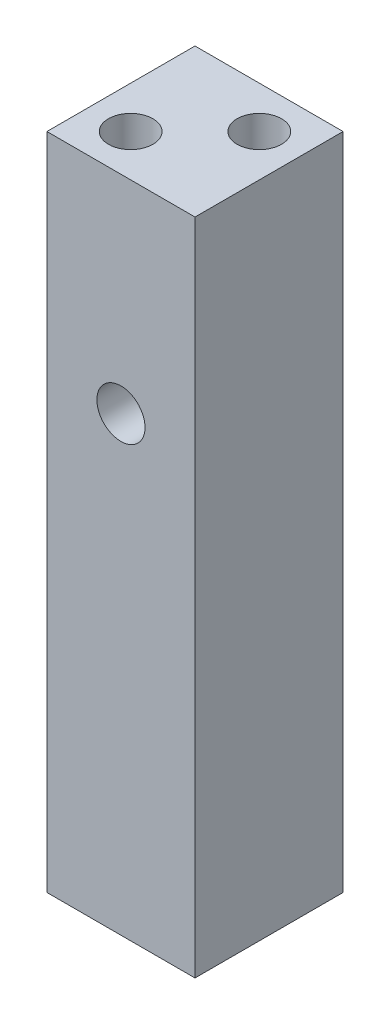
SolidWorks part; units mm, degrees
ref_plane "Front Plane" through (0, 0, 0) normal (0, 0, 1) x (1, 0, 0)
ref_plane "Top Plane" through (0, 0, 0) normal (0, 1, 0) x (1, 0, 0)
ref_plane "Right Plane" through (0, 0, 0) normal (1, 0, 0) x (0, 0, -1)
sketch "Sketch1" plane through (0, 0, 0) normal (0, 1, 0) x (1, 0, 0)
  line L1 (0, 0) -> (20, 0)
  line L2 (0, 0) -> (0, 20)
  line L3 (0, 20) -> (20, 20)
  line L4 (20, 0) -> (20, 20)
  dimension "D1" = 20
  dimension "D3" = 20
extrude "Extrude1" add sketch "Sketch1" along normal blind 89
sketch "Sketch2" plane through (0, 89, 0) normal (0, 1, 0) x (1, 0, 0)
  line L0 (20, 20) -> (0, 0) construction
  point P4 (14.3431, 14.3431)
  point P5 (5.6569, 5.6569)
  dimension "D1" = 8
  dimension "D2" = 8
sketch "Sketch3" plane through (0, 0, 0) normal (0, -1, 0) x (1, 0, 0)
  line L0 (20, -20) -> (0, 0) construction
  point P4 (14.3431, -14.3431)
  point P5 (5.6569, -5.6569)
  dimension "D1" = 8
  dimension "D2" = 8
hole_wizard "M6 Tapped Hole1" positions "3DSketch1" profile "Sketch4" tap size "M6" standard "ISO"
sketch3d "3DSketch1"
  point P0 (5.6569, 0, -5.6569)
  point P3 (14.3431, 0, -14.3431)
  point P6 (5.6569, 89, -5.6569)
  point P9 (14.3431, 89, -14.3431)
sketch "Sketch4" plane through (5.6569, 0, -5.6569) normal (1, 0, 0) x (0, 0, -1)
  line L0 (0, 0) -> (0, 11.5022)
  line L1 (0, 11.5022) -> (2.5, 10)
  line L2 (2.5, 10) -> (2.5, 12)
  line L3 (2.5, 12) -> (3, 12)
  line L4 (3, 12) -> (3, 0)
  line L5 (3, 0) -> (0, 0)
  line L10 (0, 11.5022) -> (-2.5, 10) construction
  line L11 (0, -6.35) -> (0, 107.95) construction
  dimension "Tap Drill Dia." = 5
  dimension "Tap Drill Depth" = 10
  dimension "Thread Major Dia." = 6
  dimension "Thread Depth" = 12
  dimension "Drill Angle" = 118
sketch "Sketch5" plane through (0, 0, 0) normal (0, 0, 1) x (1, 0, 0)
  line L0 (10, 89) -> (10, 47.5892) construction
  line L1 (0, 89) -> (20, 89) construction
  circle A0 centre (10, 61) radius 3.25
  dimension "D1" = 6.5
  dimension "D2" = 28
extrude "Extrude2" cut sketch "Sketch5" against normal through all
